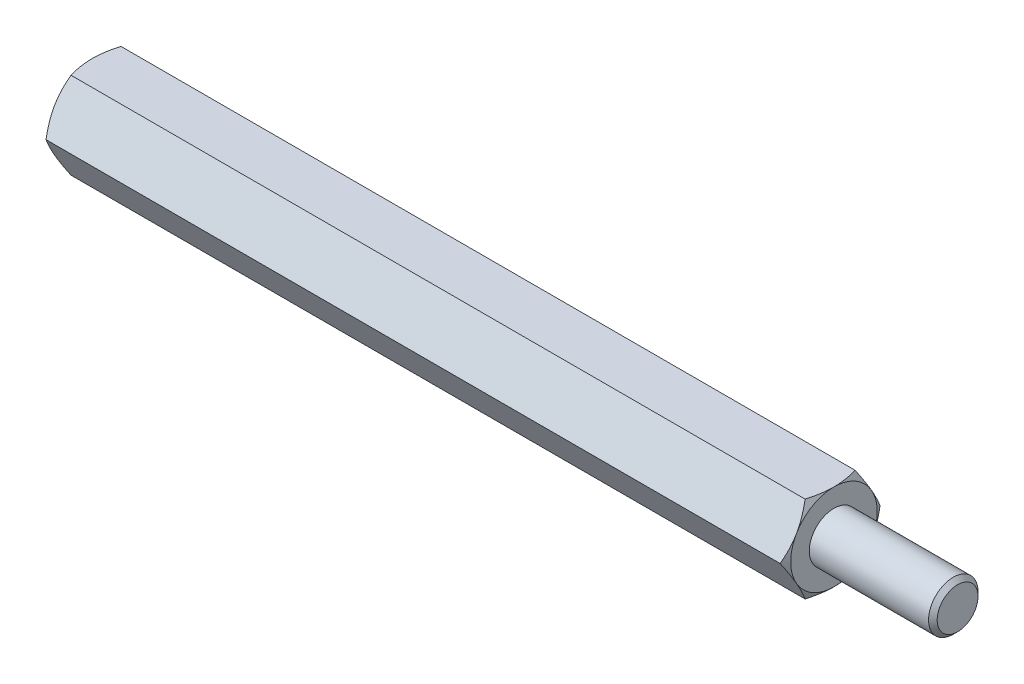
SolidWorks part; units mm, degrees
ref_plane "Front Plane" through (0, 0, 0) normal (0, 0, 1) x (1, 0, 0)
ref_plane "Top Plane" through (0, 0, 0) normal (0, 1, 0) x (1, 0, 0)
ref_plane "Right Plane" through (0, 0, 0) normal (1, 0, 0) x (0, 0, -1)
sketch "Sketch1" plane through (0, 0, 0) normal (1, 0, 0) x (0, 0, -1)
  line L1 (2.0207, 3.5) -> (-2.0207, 3.5)
  line L2 (-2.0207, 3.5) -> (-4.0415, 0)
  line L3 (-4.0415, 0) -> (-2.0207, -3.5)
  line L4 (-2.0207, -3.5) -> (2.0207, -3.5)
  line L5 (2.0207, -3.5) -> (4.0415, 0)
  line L6 (4.0415, 0) -> (2.0207, 3.5)
  circle A0 centre (0, 0) radius 3.5 construction
  dimension "D1" = 7
extrude "Extrude2" add sketch "Sketch1" along normal mid plane 60
sketch "Sketch2" plane through (0, 0, 0) normal (0, 0, 1) x (1, 0, 0)
  line L0 (-30, 3.5) -> (-28.5, 6.0981)
  line L1 (-30, 6.5) -> (-30, 3.5)
  line L3 (0, 0) -> (50000, 0) construction
  arc A0 (-28.5, 6.0981) -> (-30, 6.5) centre (-29.1962, 6.5) ccw
  dimension "D1" = 30
  dimension "D2" = 3
revolve "Cut-Revolve1" cut sketch "Sketch2" angle 360 about L3
mirror "Mirror1" about plane through (0, 0, 0) normal (1, 0, 0) of "Cut-Revolve1"
sketch "Sketch3" plane through (-30, 0, 0) normal (-1, 0, 0) x (0, 0, 1)
  circle A0 centre (0, 0) radius 1.65
  dimension "D1" = 3.3
extrude "Extrude3" cut sketch "Sketch3" against normal blind 10
sketch "Sketch4" plane through (0, 0, 0) normal (0, 0, 1) x (1, 0, 0)
  line L0 (-20, 0) -> (-20, 1.65)
  line L1 (29.6874, 0) -> (-29.6874, 0) construction
  line L2 (-20, 1.65) -> (-19.0474, 0)
  line L3 (-19.0474, 0) -> (-20, 0)
  line L4 (-30, 1.75) -> (-30, -1.75) construction
  point P4 (-30, 0)
  dimension "D1" = 30
  dimension "D2" = 1.65
  dimension "D3" = 10
revolve "Cut-Revolve2" cut sketch "Sketch4" angle 360 about L3
sketch "Sketch5" plane through (30, 0, 0) normal (1, 0, 0) x (0, 0, -1)
  circle A0 centre (0, 0) radius 2
  dimension "D1" = 4
extrude "Extrude4" add sketch "Sketch5" along normal blind 10
chamfer "Chamfer1" distance 0.35 angle 45 1 edges at (40, 0, -2)
equation "\"D2@Sketch4\" = \"D1@Sketch3\"/2"
